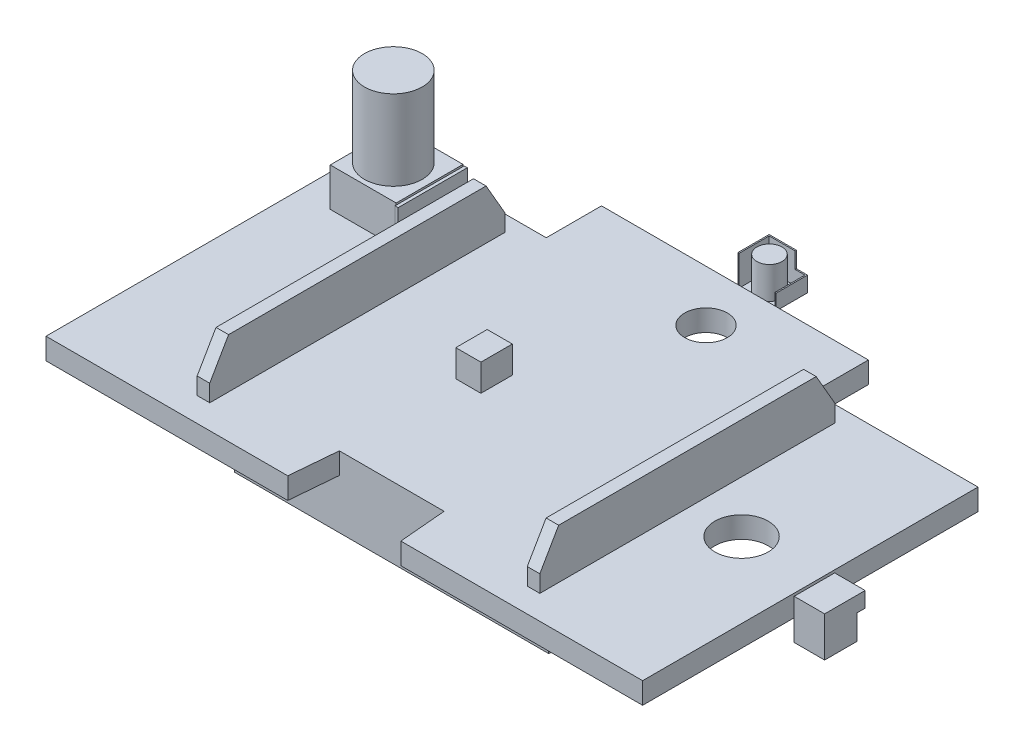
SolidWorks part; units mm, degrees
ref_plane "Ebene vorne" through (0, 0, 0) normal (0, 0, 1) x (1, 0, 0)
ref_plane "Ebene oben" through (0, 0, 0) normal (0, 1, 0) x (1, 0, 0)
ref_plane "Ebene rechts" through (0, 0, 0) normal (1, 0, 0) x (0, 0, -1)
sketch "Skizze1" plane through (0, 0, 0) normal (0, 1, 0) x (1, 0, 0)
  line L0 (-212.5, 267) -> (-212.5, 355)
  line L1 (475, -267) -> (-475, -267)
  line L2 (475, -267) -> (475, 267)
  line L3 (475, 267) -> (212.5, 267)
  line L4 (-475, -267) -> (-475, 267)
  line L5 (475, -267) -> (-475, 267) construction
  line L6 (475, 267) -> (-475, -267) construction
  line L7 (-212.5, 355) -> (212.5, 355)
  line L8 (212.5, 355) -> (212.5, 267)
  line L9 (-212.5, 267) -> (-475, 267)
  point P0 (0, 0)
  point P11 (0, 355)
  dimension "D1" = 534
  dimension "D2" = 950
  dimension "D3" = 88
  dimension "D4" = 425
extrude "Aufsatz-Linear austragen1" add sketch "Skizze1" against normal blind 34
sketch "Skizze2" plane through (0, -34, 0) normal (0, -1, 0) x (1, 0, 0)
  line L0 (-475, -267) -> (-475, 267) construction
  line L1 (-459.5, 249) -> (-334.5, 249)
  line L2 (-459.5, 249) -> (-459.5, 169)
  line L3 (-459.5, 169) -> (-334.5, 169)
  line L4 (-334.5, 249) -> (-334.5, 169)
  line L5 (459.5, 249) -> (334.5, 249)
  line L6 (459.5, 249) -> (459.5, 169)
  line L7 (459.5, 169) -> (334.5, 169)
  line L8 (334.5, 249) -> (334.5, 169)
  line L9 (334.5, -169) -> (459.5, -169)
  line L10 (334.5, -169) -> (334.5, -249)
  line L11 (334.5, -249) -> (459.5, -249)
  line L12 (459.5, -169) -> (459.5, -249)
  line L13 (-334.5, -169) -> (-459.5, -169)
  line L14 (-334.5, -169) -> (-334.5, -249)
  line L15 (-334.5, -249) -> (-459.5, -249)
  line L16 (-459.5, -169) -> (-459.5, -249)
  line L17 (-475, 267) -> (475, 267) construction
  line L18 (475, -267) -> (212.5, -267) construction
  line L19 (475, 267) -> (475, -267) construction
  dimension "D1" = 15.5
  dimension "D2" = 18
  dimension "D3" = 125
  dimension "D4" = 80
  dimension "D5" = 18
  dimension "D6" = 15.5
extrude "Aufsatz-Linear austragen2" [suppressed] add sketch "Skizze2" along normal offset from surface (20 mm away) 43
sketch "Skizze3" plane through (0, -34, 0) normal (0, -1, 0) x (1, 0, 0)
  line L0 (0, 52) -> (0, -73) construction
  line L1 (-20, 97) -> (20, 97)
  line L2 (-20, 97) -> (-20, 52)
  line L3 (-20, 52) -> (20, 52)
  line L4 (20, 97) -> (20, 52)
  line L5 (-20, -73) -> (20, -73)
  line L6 (-20, -73) -> (-20, -118)
  line L7 (-20, -118) -> (20, -118)
  line L8 (20, -73) -> (20, -118)
  line L10 (212.5, -267) -> (212.5, -355) construction
  line L11 (212.5, -355) -> (-212.5, -355) construction
  dimension "D1" = 40
  dimension "D2" = 125
  dimension "D3" = 452
  dimension "D4" = 192.5
  dimension "D5" = 45
extrude "Aufsatz-Linear austragen3" add sketch "Skizze3" along normal offset from surface (31 mm away) 65
sketch "Skizze4" plane through (0, 0, 0) normal (0, 1, 0) x (1, 0, 0)
  line L0 (355, 10.5) -> (0, 10.5) construction
  line L1 (475, -267) -> (475, 267) construction
  circle A0 centre (355, 10.5) radius 42.5
  dimension "D1" = 85
  dimension "D2" = 120
  dimension "D4" = 10.5
extrude "Schnitt-Linear austragen1" cut sketch "Skizze4" against normal through all
sketch "Skizze5" plane through (0, 0, 0) normal (0, 1, 0) x (1, 0, 0)
  line L0 (-455, 180) -> (-335, 180) construction
  line L1 (-335, 180) -> (-215, 180) construction
  line L2 (-215, 180) -> (-95, 180) construction
  line L3 (-95, 180) -> (-95, 60) construction
  line L4 (-95, 60) -> (-95, -60) construction
  line L5 (-95, -60) -> (-95, -180) construction
  line L6 (-95, -180) -> (-215, -180) construction
  line L7 (-215, -180) -> (-335, -180) construction
  line L8 (-335, -180) -> (-455, -180) construction
  line L9 (-455, -180) -> (-455, -60) construction
  line L10 (-455, -60) -> (-455, 60) construction
  line L11 (-455, 60) -> (-455, 180) construction
  line L12 (-335, 180) -> (-335, 60) construction
  line L13 (-335, 60) -> (-335, -60) construction
  line L14 (-335, -60) -> (-335, -180) construction
  line L15 (-215, 180) -> (-215, 60) construction
  line L16 (-215, 60) -> (-215, -60) construction
  line L17 (-215, -60) -> (-215, -180) construction
  line L18 (-455, 60) -> (-335, 60) construction
  line L19 (-335, 60) -> (-215, 60) construction
  line L20 (-215, 60) -> (-95, 60) construction
  line L21 (-95, -60) -> (-215, -60) construction
  line L22 (-215, -60) -> (-335, -60) construction
  line L23 (-335, -60) -> (-455, -60) construction
  line L24 (0, 0) -> (-95, 0) construction
  line L25 (-475, 267) -> (-475, -267) construction
  dimension "D1" = 120
  dimension "D2" = 20
sketch "Skizze13" plane through (475, 0, 0) normal (1, 0, 0) x (0, 0, -1)
  line L1 (-25.7, -4.3) -> (43.8, -4.3)
  line L2 (-25.7, -4.3) -> (-25.7, -68)
  line L3 (-25.7, -68) -> (43.8, -68)
  line L4 (43.8, -4.3) -> (43.8, -68)
  line L5 (-267, 0) -> (267, 0) construction
  line L6 (-267, -34) -> (-267, 0) construction
  point P9 (-267, -17)
  dimension "D1" = 4.3
  dimension "D2" = 69.5
  dimension "D3" = 241.3
  dimension "D4" = 63.7
extrude "Aufsatz-Linear austragen4" add sketch "Skizze13" along normal blind 48.5 and the other way blind 17.5
sketch "Skizze16" plane through (0, -68, 0) normal (0, -1, 0) x (1, 0, 0)
  line L0 (488, 0) -> (0, 0) construction
  line L1 (517.0467, 7.7) -> (523.5, 7.7)
  line L2 (523.5, 25.7) -> (523.5, -43.8) construction
  line L3 (457.5, -43.8) -> (523.5, -43.8) construction
  line L4 (475, -43.8) -> (475, -27.0925)
  line L5 (523.5, 7.7) -> (523.5, 25.7)
  line L6 (523.5, 25.7) -> (457.5, 25.7)
  line L7 (457.5, 25.7) -> (457.5, -43.8)
  line L8 (457.5, -43.8) -> (475, -43.8)
  arc A0 (517.0467, 7.7) -> (475, -27.0925) centre (488, 0) ccw
  dimension "D1" = 60.1
  dimension "D3" = 35.5
  dimension "D2" = 51.5
extrude "Schnitt-Linear austragen4" [suppressed] cut sketch "Skizze16" against normal up to surface (39 mm away)
sketch "Skizze17" plane through (0, -68, 0) normal (0, -1, 0) x (1, 0, 0)
  line L0 (523.5, 25.7) -> (523.5, -43.8) construction
  line L1 (355, -10.5) -> (489.197, -10.5) construction
  line L2 (523.5, -25.8) -> (515.0604, -25.8)
  line L3 (475, 25.7) -> (475, 15.9849)
  line L4 (475, 25.7) -> (457.5, 25.7)
  line L5 (457.5, 25.7) -> (457.5, -43.8)
  line L6 (457.5, -43.8) -> (523.5, -43.8)
  line L7 (523.5, -43.8) -> (523.5, -25.8)
  line L8 (457.5, 25.7) -> (523.5, 25.7) construction
  arc A0 (475, 15.9849) -> (515.0604, -25.8) centre (489.197, -10.5) ccw
  dimension "D2" = 60.1
  dimension "D1" = 34.303
  dimension "D3" = 51.5
extrude "Schnitt-Linear austragen5" cut sketch "Skizze17" against normal up to surface (34 mm away)
sketch "Skizze18" plane through (0, 0, 0) normal (0, 1, 0) x (1, 0, 0)
  line L0 (475, -267) -> (475, 267) construction
  line L1 (-416.9, 233.98) -> (-311.9, 233.98)
  line L2 (-416.9, 233.98) -> (-416.9, 127.48)
  line L3 (-416.9, 127.48) -> (-311.9, 127.48)
  line L4 (-311.9, 233.98) -> (-311.9, 127.48)
  line L5 (-475, -267) -> (475, -267) construction
  dimension "D1" = 106.5
  dimension "D2" = 105
  dimension "D3" = 891.9
  dimension "D4" = 394.48
extrude "Aufsatz-Linear austragen5" add sketch "Skizze18" along normal blind 61.3 from offset 6.7 separate body
sketch "Skizze19" plane through (0, 68, 0) normal (0, 1, 0) x (1, 0, 0)
  line L0 (-416.9, 233.98) -> (-416.9, 127.48) construction
  line L1 (-369.7, 180.73) -> (-311.9, 180.73) construction
  line L2 (-311.9, 127.48) -> (-311.9, 233.98) construction
  circle A0 centre (-369.7, 180.73) radius 46
  dimension "D1" = 92
  dimension "D2" = 47.2
extrude "Aufsatz-Linear austragen6" add sketch "Skizze19" along normal blind 127.5
sketch "Skizze20" plane through (0, 0, -127.48) normal (0, 0, 1) x (1, 0, 0)
  line L0 (-311.9, 65) -> (-311.9, 0)
  line L1 (-311.9, 68) -> (-311.9, 6.7) construction
  line L2 (-475, 0) -> (475, 0) construction
  line L3 (-311.9, 0) -> (-277.5, 0)
  dimension "D1" = 65
  dimension "D2" = 34.4
extrude "Linear-Austragen-Dünn1" add sketch "Skizze20" along normal mid plane 110 from offset 53.25 thin
sketch "Skizze21" plane through (0, -34, 0) normal (0, -1, 0) x (1, 0, 0)
  line L12 (523.5, -43.8) -> (523.5, -25.8)
  line L13 (475, -267) -> (475, -43.8)
  line L14 (475, -43.8) -> (523.5, -43.8)
  line L15 (523.5, -43.8) -> (523.5, -25.8)
  line L16 (523.5, -25.8) -> (515.0604, -25.8)
  line L17 (523.5, -25.8) -> (515.0604, -25.8)
  line L18 (475, 25.7) -> (475, 267)
  line L19 (475, 267) -> (-475, 267)
  line L20 (-475, 267) -> (-475, -267)
  line L21 (-475, -267) -> (-212.5, -267)
  line L22 (-212.5, -267) -> (-212.5, -355)
  line L23 (-212.5, -355) -> (212.5, -355)
  line L24 (212.5, -355) -> (212.5, -267)
  line L25 (212.5, -267) -> (475, -267)
  line L26 (475, -267) -> (475, -34.7849)
  line L27 (475, -43.8) -> (523.5, -43.8)
  line L40 (475, 15.9849) -> (475, 25.7)
  arc A1 (475, 15.9849) -> (515.0604, -25.8) centre (489.197, -10.5) ccw
  arc A3 (475, 15.9849) -> (515.0604, -25.8) centre (489.197, -10.5) ccw
  dimension "D1" = 0
extrude "Schnitt-Linear austragen6" cut sketch "Skizze21" against normal blind 5.3 contours L26 M16 M17 M18 M19
sketch "Skizze22" plane through (0, 0, -43.8) normal (0, 0, -1) x (-1, 0, 0)
  line L4 (-523.5, -4.3) -> (-523.5, -28.7)
  line L5 (-523.5, -28.7) -> (-475, -28.7)
  line L6 (-475, -28.7) -> (-475, -4.3)
  line L7 (-475, -4.3) -> (-523.5, -4.3)
  line L8 (-523.5, -4.3) -> (-523.5, -28.7)
  line L9 (-523.5, -28.7) -> (-475, -28.7)
  line L10 (-475, -28.7) -> (-475, -4.3)
  line L11 (-475, -4.3) -> (-523.5, -4.3)
  dimension "D1" = 0
extrude "Schnitt-Linear austragen7" cut sketch "Skizze22" against normal blind 5
sketch "Skizze23" plane through (0, 0, 0) normal (0, 1, 0) x (-1, 0, 0)
  line L0 (475, 267) -> (-475, 267) construction
  line L1 (90, -0.5) -> (50, -0.5)
  line L2 (90, -0.5) -> (90, -50.5)
  line L3 (90, -50.5) -> (50, -50.5)
  line L4 (50, -0.5) -> (50, -50.5)
  line L5 (475, -267) -> (475, 267) construction
  point P8 (70, -0.5)
  dimension "D1" = 267.5
  dimension "D2" = 385
  dimension "D3" = 50
  dimension "D4" = 40
extrude "Aufsatz-Linear austragen7" add sketch "Skizze23" along normal blind 43
sketch "Skizze24" plane through (0, 0, 0) normal (0, 1, 0) x (1, 0, 0)
  line L0 (212.5, 355) -> (-212.5, 355) construction
  line L1 (212.5, 267) -> (212.5, 355) construction
  circle A0 centre (35.42, 273.5) radius 34
  dimension "D1" = 81.5
  dimension "D3" = 68
  dimension "D2" = 177.08
extrude "Schnitt-Linear austragen8" cut sketch "Skizze24" against normal through all
sketch "Skizze25" plane through (0, 0, -355) normal (0, 0, -1) x (-1, 0, 0)
  line L0 (-212.5, -34) -> (-212.5, 0) construction
  line L1 (-65.46, -6) -> (-4.46, -6)
  line L2 (-65.46, -6) -> (-65.46, 44)
  line L3 (-65.46, 44) -> (-4.46, 44)
  line L4 (-4.46, -6) -> (-4.46, 44)
  line L5 (-212.5, -34) -> (212.5, -34) construction
  dimension "D1" = 61
  dimension "D2" = 50
  dimension "D3" = 147.04
  dimension "D4" = 28
extrude "Aufsatz-Linear austragen8" add sketch "Skizze25" along normal blind 50.01
sketch "Skizze27" plane through (0, 0, -405.01) normal (0, 0, -1) x (-1, 0, 0)
  line L1 (-65.46, 44) -> (-47.96, 44)
  line L2 (-65.46, 44) -> (-65.46, 18.5)
  line L3 (-65.46, 18.5) -> (-47.96, 18.5)
  line L4 (-47.96, 44) -> (-47.96, 18.5)
  dimension "D1" = 25.5
  dimension "D2" = 17.5
extrude "Schnitt-Linear austragen10" cut sketch "Skizze27" against normal up to surface (50.01 mm away)
sketch "Skizze26" plane through (0, 44, 0) normal (0, 1, 0) x (1, 0, 0)
  line L0 (4.46, 405.01) -> (4.46, 355) construction
  line L1 (6.46, 355) -> (63.46, 355)
  line L2 (6.46, 355) -> (6.46, 403.01)
  line L3 (6.46, 403.01) -> (63.46, 403.01)
  line L4 (63.46, 355) -> (63.46, 403.01)
  line L5 (34.96, 403.01) -> (34.96, 355) construction
  line L6 (6.46, 379.005) -> (63.46, 379.005) construction
  line L7 (65.46, 405.01) -> (65.46, 355) construction
  line L8 (4.46, 405.01) -> (47.96, 405.01) construction
  line L10 (4.46, 355) -> (47.96, 355) construction
  dimension "D1" = 2
  dimension "D2" = 2
  dimension "D3" = 2
extrude "Schnitt-Linear austragen9" cut sketch "Skizze26" against normal blind 48
sketch "Skizze28" plane through (0, -4, 0) normal (0, 1, 0) x (1, 0, 0)
  line L1 (4.46, 405.01) -> (47.96, 405.01) construction
  circle A0 centre (34.96, 374.995) radius 20.05
  circle A1 centre (35.42, 273.5) radius 34 construction
  dimension "D1" = 40.1
  dimension "D2" = 0.46
  dimension "D3" = 30.015
extrude "Aufsatz-Linear austragen9" add sketch "Skizze28" along normal blind 51
sketch "Skizze29" plane through (0, 0, 0) normal (0, 1, 0) x (1, 0, 0)
  line L0 (-475, -267) -> (475, -267) construction
  line L3 (-90, -267) -> (90, -267)
  line L5 (0, -191.5) -> (0, -267) construction
  line L7 (90, -267) -> (83.3946, -191.5)
  line L8 (83.3946, -191.5) -> (-83.3946, -191.5)
  line L9 (-83.3946, -191.5) -> (-90, -267)
  dimension "D1" = 95
  dimension "D2" = 75.5
  dimension "D3" = 166.7892
  dimension "D7" = 180
extrude "Schnitt-Linear austragen11" cut sketch "Skizze29" against normal up to surface (34 mm away)
sketch "Skizze30" plane through (0, 0, 0) normal (0, 1, 0) x (1, 0, 0)
  line L0 (83.3946, -191.5) -> (-83.3946, -191.5) construction
  line L1 (-272.8, 241.5) -> (-252.8, 241.5)
  line L2 (-272.8, 241.5) -> (-272.8, -228.5)
  line L3 (-272.8, -228.5) -> (-252.8, -228.5)
  line L4 (-252.8, 241.5) -> (-252.8, -228.5)
  line L5 (252.8, 241.5) -> (272.8, 241.5)
  line L6 (252.8, 241.5) -> (252.8, -228.5)
  line L7 (252.8, -228.5) -> (272.8, -228.5)
  line L8 (272.8, 241.5) -> (272.8, -228.5)
  line L9 (0, -191.5) -> (0, 212.4608) construction
  line L10 (-212.5, 267) -> (-475, 267) construction
  dimension "D1" = 470
  dimension "D2" = 20
  dimension "D3" = 505.6
  dimension "D4" = 25.5
extrude "Aufsatz-Linear austragen10" add sketch "Skizze30" along normal blind 79
sketch "Skizze31" plane through (0, -34, 0) normal (0, -1, 0) x (1, 0, 0)
  line L0 (-475, 267) -> (-90, 267) construction
  line L1 (-250, 191.5) -> (250, 191.5)
  line L2 (-250, 191.5) -> (-250, 171.5)
  line L3 (-250, 171.5) -> (250, 171.5)
  line L4 (250, 191.5) -> (250, 171.5)
  line L5 (-290, -184.5) -> (290, -184.5)
  line L6 (-290, -184.5) -> (-290, -204.5)
  line L7 (-290, -204.5) -> (290, -204.5)
  line L8 (290, -184.5) -> (290, -204.5)
  line L9 (0, 191.5) -> (0, -141.9356) construction
  line L10 (83.3946, 191.5) -> (-83.3946, 191.5) construction
  dimension "D1" = 20
  dimension "D2" = 356
  dimension "D3" = 500
  dimension "D4" = 580
  dimension "D5" = 75.5
extrude "Aufsatz-Linear austragen11" add sketch "Skizze31" along normal blind 79
chamfer "Fase1" distance 30 angle 60 6 edges at (-262.8, 79, 228.5) (-262.8, 79, -241.5) (262.8, 79, -241.5) (262.8, 79, 228.5) (290, -113, -194.5) (-290, -113, -194.5)
